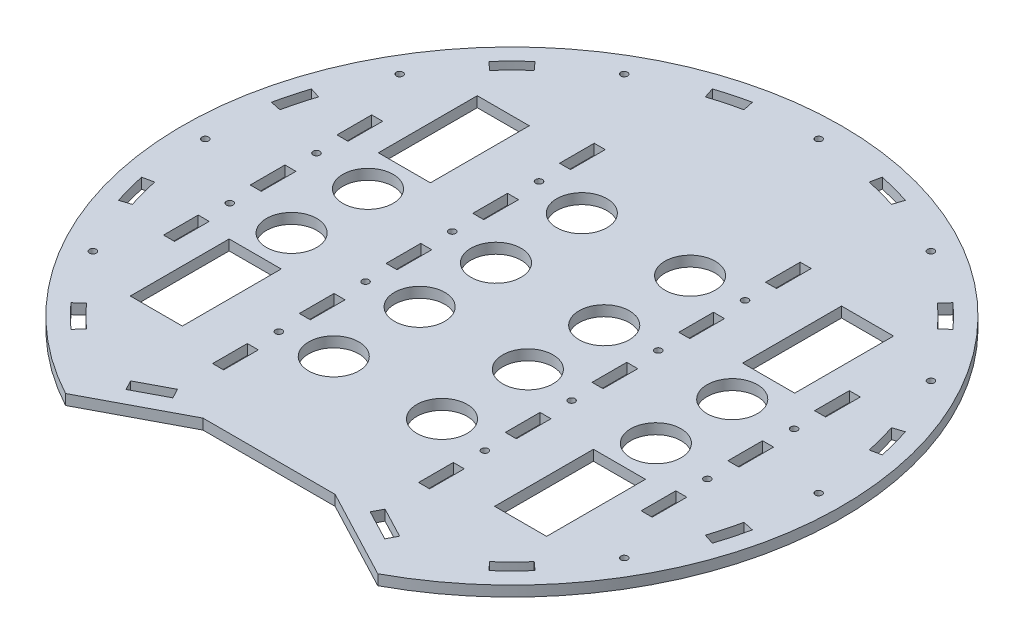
SolidWorks part; units mm, degrees
ref_plane "Front Plane" through (0, 0, 0) normal (0, 0, 1) x (1, 0, 0)
ref_plane "Top Plane" through (0, 0, 0) normal (0, 1, 0) x (1, 0, 0)
ref_plane "Right Plane" through (0, 0, 0) normal (1, 0, 0) x (0, 0, -1)
sketch "Sketch1" plane through (0, 0, 0) normal (0, 1, 0) x (1, 0, 0)
  line L0 (-106.3364, -157.4566) -> (-42.1421, -123.65) construction
  line L1 (-120, -100.0099) -> (-90, -100.0099)
  line L2 (-120, -100.0099) -> (-120, -43.0099)
  line L3 (-120, -43.0099) -> (-90, -43.0099)
  line L4 (-90, -100.0099) -> (-90, -43.0099)
  line L5 (-120, 43.0099) -> (-90, 43.0099)
  line L6 (-120, 43.0099) -> (-120, 100.0099)
  line L7 (-120, 100.0099) -> (-90, 100.0099)
  line L8 (-90, 43.0099) -> (-90, 100.0099)
  line L9 (90, 100.0099) -> (120, 100.0099)
  line L10 (90, 100.0099) -> (90, 43.0099)
  line L11 (90, 43.0099) -> (120, 43.0099)
  line L12 (120, 100.0099) -> (120, 43.0099)
  line L13 (120, -43.0099) -> (90, -43.0099)
  line L14 (120, -43.0099) -> (120, -100.0099)
  line L15 (120, -100.0099) -> (90, -100.0099)
  line L16 (90, -43.0099) -> (90, -100.0099)
  line L17 (-42.1421, -123.65) -> (42.1421, -123.65) construction
  line L18 (0, 190) -> (0, -190) construction
  line L19 (-105, 43.0099) -> (-105, -43.0099) construction
  line L20 (-190, 0) -> (190, 0) construction
  line L33 (140.85, -40) -> (140.85, -60)
  line L34 (-134.5, 40) -> (-140.85, 40)
  line L35 (-134.5, 40) -> (-134.5, 60)
  line L36 (-134.5, 60) -> (-140.85, 60)
  line L37 (-140.85, 40) -> (-140.85, 60)
  line L38 (-134.5, 10) -> (-140.85, 10)
  line L39 (-134.5, 10) -> (-134.5, -10)
  line L40 (-134.5, -10) -> (-140.85, -10)
  line L41 (-140.85, 10) -> (-140.85, -10)
  line L46 (-134.5, -40) -> (-140.85, -40)
  line L47 (-134.5, -40) -> (-134.5, -60)
  line L48 (-134.5, -60) -> (-140.85, -60)
  line L49 (-140.85, -40) -> (-140.85, -60)
  line L50 (134.5, -60) -> (140.85, -60)
  line L51 (134.5, -40) -> (134.5, -60)
  line L52 (134.5, -40) -> (140.85, -40)
  line L53 (140.85, 10) -> (140.85, -10)
  line L54 (134.5, -10) -> (140.85, -10)
  line L55 (134.5, 10) -> (134.5, -10)
  line L56 (134.5, 10) -> (140.85, 10)
  line L57 (140.85, 40) -> (140.85, 60)
  line L58 (134.5, 60) -> (140.85, 60)
  line L59 (134.5, 40) -> (134.5, 60)
  line L60 (134.5, 40) -> (140.85, 40)
  line L73 (42.1421, -123.65) -> (106.3364, -157.4566) construction
  line L86 (0, 0) -> (-37.4241, 176.0666) construction
  line L99 (-155.3051, -190) -> (147.1552, -190) construction
  line L100 (-128.4523, -140) -> (128.4523, -140) construction
  line L101 (-90, -167.332) -> (-38.1, -140)
  line L102 (-38.1, -140) -> (38.1, -140)
  line L103 (38.1, -140) -> (90, -167.332)
  line L104 (-53.6608, 165.151) -> (-55.6231, 171.1902)
  line L105 (0, 0) -> (-55.6231, 171.1902) construction
  line L126 (105, 43.0099) -> (105, -43.0099) construction
  line L127 (-37.4241, 176.0666) -> (-36.1039, 169.8553)
  line L128 (-100.2255, -161.4151) -> (-40.5722, -130) construction
  line L129 (-120.4435, 133.7661) -> (-116.1945, 129.0471)
  line L130 (-40.5722, -130) -> (40.5722, -130) construction
  line L131 (40.5722, -130) -> (100.2255, -161.4151) construction
  line L132 (-129.0471, 116.1945) -> (-133.7661, 120.4435)
  line L133 (-171.1902, 55.6231) -> (-165.151, 53.6608)
  line L134 (-169.8553, 36.1039) -> (-176.0666, 37.4241)
  line L135 (-176.0666, -37.4241) -> (-169.8553, -36.1039)
  line L136 (-165.151, -53.6608) -> (-171.1902, -55.6231)
  line L137 (-133.7661, -120.4435) -> (-129.0471, -116.1945)
  line L138 (-116.1945, -129.0471) -> (-120.4435, -133.7661)
  line L139 (0, 0) -> (-36.1039, 169.8553) construction
  line L140 (56.2033, -10) -> (62.5533, -10)
  line L141 (116.1945, -129.0471) -> (120.4435, -133.7661)
  line L142 (133.7661, -120.4435) -> (129.0471, -116.1945)
  line L143 (165.151, -53.6608) -> (171.1902, -55.6231)
  line L144 (176.0666, -37.4241) -> (169.8553, -36.1039)
  line L145 (169.8553, 36.1039) -> (176.0666, 37.4241)
  line L146 (171.1902, 55.6231) -> (165.151, 53.6608)
  line L147 (129.0471, 116.1945) -> (133.7661, 120.4435)
  line L148 (120.4435, 133.7661) -> (116.1945, 129.0471)
  line L149 (37.4241, 176.0666) -> (36.1039, 169.8553)
  line L150 (53.6608, 165.151) -> (55.6231, 171.1902)
  line L151 (-56.8793, -138.5878) -> (-59.8381, -132.9693)
  line L152 (-59.8381, -132.9693) -> (-77.5342, -142.2885)
  line L153 (-77.5342, -142.2885) -> (-74.5754, -147.907)
  line L154 (-74.5754, -147.907) -> (-56.8793, -138.5878)
  line L155 (77.5342, -142.2885) -> (74.5754, -147.907)
  line L156 (74.5754, -147.907) -> (56.8793, -138.5878)
  line L157 (56.8793, -138.5878) -> (59.8381, -132.9693)
  line L158 (59.8381, -132.9693) -> (77.5342, -142.2885)
  line L159 (-62.5533, 40) -> (-56.2033, 40)
  line L164 (-56.2033, 10) -> (-62.5533, 10)
  line L165 (-56.2033, 10) -> (-56.2033, -10)
  line L166 (-56.2033, -10) -> (-62.5533, -10)
  line L167 (-62.5533, 10) -> (-62.5533, -10)
  line L168 (-62.5533, 40) -> (-62.5533, 60)
  line L169 (-62.5533, 60) -> (-56.2033, 60)
  line L170 (-56.2033, 40) -> (-56.2033, 60)
  line L171 (-62.5533, 90) -> (-56.2033, 90)
  line L172 (-62.5533, 90) -> (-62.5533, 110)
  line L173 (-62.5533, 110) -> (-56.2033, 110)
  line L174 (-56.2033, 90) -> (-56.2033, 110)
  line L175 (-62.5533, -40) -> (-56.2033, -40)
  line L176 (-62.5533, -40) -> (-62.5533, -60)
  line L177 (-62.5533, -60) -> (-56.2033, -60)
  line L178 (-56.2033, -40) -> (-56.2033, -60)
  line L179 (-62.5533, -90) -> (-56.2033, -90)
  line L180 (-62.5533, -90) -> (-62.5533, -110)
  line L181 (-62.5533, -110) -> (-56.2033, -110)
  line L182 (-56.2033, -90) -> (-56.2033, -110)
  line L183 (62.5533, -60) -> (56.2033, -60)
  line L184 (56.2033, -40) -> (56.2033, -60)
  line L185 (62.5533, -40) -> (62.5533, -60)
  line L186 (62.5533, -40) -> (56.2033, -40)
  line L187 (62.5533, -110) -> (56.2033, -110)
  line L188 (62.5533, -90) -> (56.2033, -90)
  line L189 (56.2033, -90) -> (56.2033, -110)
  line L190 (62.5533, -90) -> (62.5533, -110)
  line L191 (56.2033, 90) -> (56.2033, 110)
  line L192 (62.5533, 110) -> (56.2033, 110)
  line L193 (62.5533, 90) -> (62.5533, 110)
  line L194 (62.5533, 90) -> (56.2033, 90)
  line L195 (56.2033, 40) -> (56.2033, 60)
  line L196 (62.5533, 60) -> (56.2033, 60)
  line L197 (62.5533, 40) -> (62.5533, 60)
  line L198 (62.5533, 10) -> (62.5533, -10)
  line L199 (56.2033, 10) -> (56.2033, -10)
  line L200 (56.2033, 10) -> (62.5533, 10)
  line L201 (62.5533, 40) -> (56.2033, 40)
  line L202 (-134.5, -60) -> (-134.5, -109.8366) construction
  line L203 (-134.5, 60) -> (-134.5, 109.8366) construction
  line L204 (-56.2033, 110) -> (-56.2033, 164.3031) construction
  line L205 (-56.2033, -110) -> (-56.2033, -131.0551) construction
  line L206 (-137.675, 40) -> (-137.675, 10) construction
  line L207 (-137.675, -10) -> (-137.675, -40) construction
  line L208 (-59.3783, 40) -> (-59.3783, 10) construction
  line L209 (-59.3783, -10) -> (-59.3783, -40) construction
  line L210 (-59.3783, -60) -> (-59.3783, -90) construction
  line L211 (-59.3783, 90) -> (-59.3783, 60) construction
  line L212 (0, 180.0144) -> (0, 173.65) construction
  line L213 (0, 0) -> (0, 176.8322) construction
  line L214 (0, 0) -> (88.4161, 153.1412) construction
  circle A0 centre (0, 0) radius 190 construction
  arc A3 (-90, -167.332) -> (90, -167.332) centre (0, 0) cw
  circle A4 centre (-105, -22.0099) radius 14.5
  circle A5 centre (-105, 22.0099) radius 14.5
  circle A6 centre (105, 22.0099) radius 14.5
  circle A7 centre (105, -22.0099) radius 14.5
  circle A16 centre (0, 0) radius 180 construction
  circle A17 centre (0, 0) radius 173.65 construction
  arc A18 (-55.6231, 171.1902) -> (-37.4241, 176.0666) centre (0, 0) cw
  arc A19 (-53.6608, 165.151) -> (-36.1039, 169.8553) centre (0, 0) cw
  arc A20 (-133.7661, 120.4435) -> (-120.4435, 133.7661) centre (0, 0) cw
  arc A21 (-129.0471, 116.1945) -> (-116.1945, 129.0471) centre (0, 0) cw
  arc A22 (-176.0666, 37.4241) -> (-171.1902, 55.6231) centre (0, 0) cw
  arc A23 (-169.8553, 36.1039) -> (-165.151, 53.6608) centre (0, 0) cw
  arc A24 (-171.1902, -55.6231) -> (-176.0666, -37.4241) centre (0, 0) cw
  arc A25 (-165.151, -53.6608) -> (-169.8553, -36.1039) centre (0, 0) cw
  arc A26 (-120.4435, -133.7661) -> (-133.7661, -120.4435) centre (0, 0) cw
  arc A27 (-116.1945, -129.0471) -> (-129.0471, -116.1945) centre (0, 0) cw
  arc A28 (120.4435, -133.7661) -> (133.7661, -120.4435) centre (0, 0) ccw
  arc A29 (116.1945, -129.0471) -> (129.0471, -116.1945) centre (0, 0) ccw
  arc A30 (165.151, -53.6608) -> (169.8553, -36.1039) centre (0, 0) ccw
  arc A31 (171.1902, -55.6231) -> (176.0666, -37.4241) centre (0, 0) ccw
  arc A32 (176.0666, 37.4241) -> (171.1902, 55.6231) centre (0, 0) ccw
  arc A33 (169.8553, 36.1039) -> (165.151, 53.6608) centre (0, 0) ccw
  arc A34 (133.7661, 120.4435) -> (120.4435, 133.7661) centre (0, 0) ccw
  arc A35 (129.0471, 116.1945) -> (116.1945, 129.0471) centre (0, 0) ccw
  arc A36 (53.6608, 165.151) -> (36.1039, 169.8553) centre (0, 0) ccw
  arc A37 (55.6231, 171.1902) -> (37.4241, 176.0666) centre (0, 0) ccw
  circle A38 centre (-31.2033, 22.0099) radius 14.5
  circle A39 centre (-31.2033, 71.5099) radius 14.5
  circle A40 centre (-31.2033, -22.0099) radius 14.5
  circle A41 centre (-31.2033, -71.5099) radius 14.5
  circle A42 centre (31.2033, -71.5099) radius 14.5
  circle A43 centre (31.2033, -22.0099) radius 14.5
  circle A44 centre (31.2033, 71.5099) radius 14.5
  circle A45 centre (31.2033, 22.0099) radius 14.5
  circle A47 centre (-59.3783, 75) radius 1.9558
  circle A48 centre (-59.3783, 25) radius 1.9558
  circle A49 centre (-137.675, 25) radius 1.9558
  circle A50 centre (-137.675, -25) radius 1.9558
  circle A51 centre (-59.3783, -25) radius 1.9558
  circle A52 centre (-59.3783, -75) radius 1.9558
  circle A53 centre (0, 176.8322) radius 1.9558
  circle A54 centre (88.4161, 153.1412) radius 1.9558
  circle A55 centre (153.1412, 88.4161) radius 1.9558
  circle A56 centre (176.8322, 0) radius 1.9558
  circle A57 centre (153.1412, -88.4161) radius 1.9558
  circle A58 centre (-88.4161, 153.1412) radius 1.9558
  circle A59 centre (-153.1412, 88.4161) radius 1.9558
  circle A60 centre (-176.8322, 0) radius 1.9558
  circle A61 centre (-153.1412, -88.4161) radius 1.9558
  circle A62 centre (59.3783, 75) radius 1.9558
  circle A63 centre (59.3783, 25) radius 1.9558
  circle A64 centre (59.3783, -75) radius 1.9558
  circle A65 centre (59.3783, -25) radius 1.9558
  circle A66 centre (137.675, -25) radius 1.9558
  circle A67 centre (137.675, 25) radius 1.9558
  point P71 (-59.3783, 90)
  point P116 (0, -140)
  point P166 (-90, -71.5099)
  point P168 (-90, 71.5099)
  point P199 (-56.2033, 0)
  point P225 (0, 0)
  dimension "D1" = 380
  dimension "D5" = 90
  dimension "D25" = 29
  dimension "D30" = 360
  dimension "D31" = 347.3
  dimension "D38" = 20
  dimension "D40" = 3.9116
  dimension "D3" = 30
  dimension "D4" = 57
  dimension "D6" = 6.35
  dimension "D7" = 71.9467
  dimension "D8" = 20
  dimension "D9" = 30
  dimension "D10" = 30
  dimension "D11" = 30
  dimension "D12" = 14.5
  dimension "D13" = 200.0199
  dimension "D14" = 100.0099
  dimension "D15" = 90
  dimension "D16" = 6.35
  dimension "D17" = 50
  dimension "D18" = 76.2
  dimension "D19" = 6.35
  dimension "D20" = 6.35
  dimension "D21" = 30
  dimension "D22" = 30
  dimension "D23" = 54.3031
  dimension "D24" = 49.8366
  dimension "D26" = 21
  dimension "D27" = 21
  dimension "D28" = 6
  dimension "D29" = 12
  dimension "D32" = 10
  dimension "D33" = 10
  dimension "D34" = 10
  dimension "D35" = 5
  dimension "D36" = 49.8366
  dimension "D37" = 21.0551
  dimension "D39" = 20
  dimension "D41" = 20
  dimension "D43" = 30
  dimension "D42" = 5
extrude "Boss-Extrude1" add sketch "Sketch1" along normal blind 6
